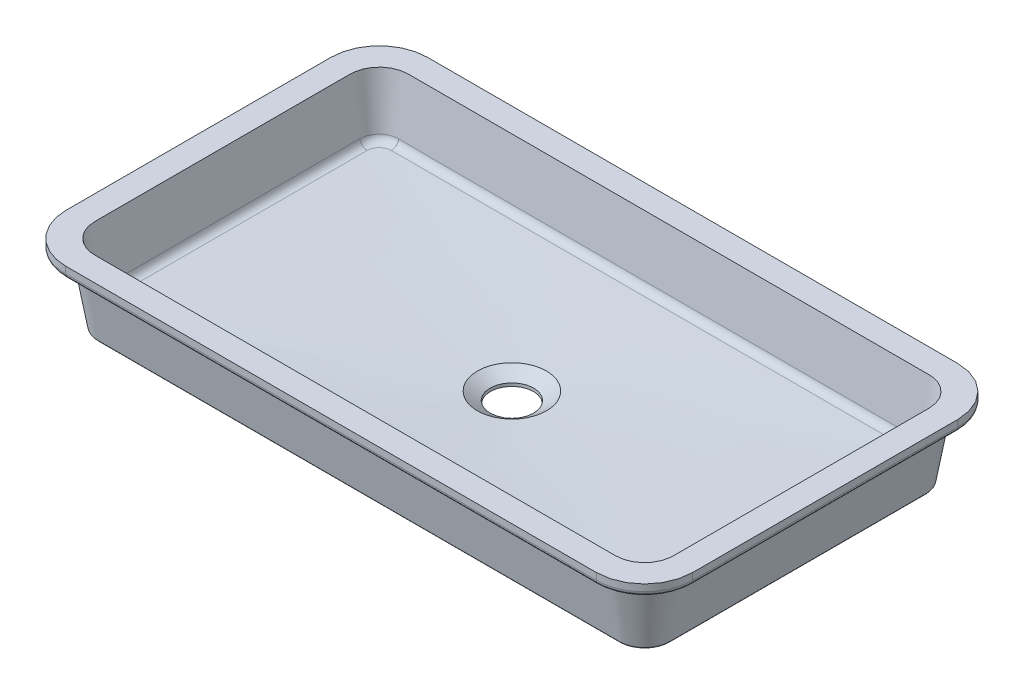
SolidWorks part; units mm, degrees
ref_plane "Front Plane" through (0, 0, 0) normal (0, 0, 1) x (1, 0, 0)
ref_plane "Top Plane" through (0, 0, 0) normal (0, 1, 0) x (1, 0, 0)
ref_plane "Right Plane" through (0, 0, 0) normal (1, 0, 0) x (0, 0, -1)
sketch "Sketch1" plane through (0, 0, 0) normal (0, 1, 0) x (1, 0, 0)
  line L0 (-263.9822, 151.1572) -> (263.7107, 151.1572)
  line L1 (288.7107, 126.1572) -> (288.7107, -126.1572)
  line L2 (263.7107, -151.1572) -> (-263.9822, -151.1572)
  line L3 (-288.9822, -126.1572) -> (-288.9822, 126.1572)
  line L4 (325, 137.5) -> (325, -137.5)
  line L5 (-325, 137.5) -> (-325, -137.5)
  line L6 (275, -187.5) -> (-275, -187.5)
  line L7 (270, 162.5) -> (-270, 162.5)
  line L8 (275, 187.5) -> (-275, 187.5)
  line L9 (300, 132.5) -> (300, -132.5)
  line L10 (270, -162.5) -> (-270, -162.5)
  line L11 (-300, 132.5) -> (-300, -132.5)
  circle A0 centre (0, 0) radius 37.225
  circle A1 centre (0, 0) radius 22.5
  arc A2 (288.7107, 126.1572) -> (263.7107, 151.1572) centre (263.7107, 126.1572) ccw
  arc A3 (263.7107, -151.1572) -> (288.7107, -126.1572) centre (263.7107, -126.1572) ccw
  arc A4 (-288.9822, -126.1572) -> (-263.9822, -151.1572) centre (-263.9822, -126.1572) ccw
  arc A5 (-263.9822, 151.1572) -> (-288.9822, 126.1572) centre (-263.9822, 126.1572) ccw
  arc A6 (275, -187.5) -> (325, -137.5) centre (275, -137.5) ccw
  arc A7 (-275, 187.5) -> (-325, 137.5) centre (-275, 137.5) ccw
  arc A8 (-325, -137.5) -> (-275, -187.5) centre (-275, -137.5) ccw
  arc A9 (270, -162.5) -> (300, -132.5) centre (270, -132.5) ccw
  arc A10 (-300, -132.5) -> (-270, -162.5) centre (-270, -132.5) ccw
  arc A11 (-270, 162.5) -> (-300, 132.5) centre (-270, 132.5) ccw
  arc A12 (325, 137.5) -> (275, 187.5) centre (275, 137.5) ccw
  arc A13 (300, 132.5) -> (270, 162.5) centre (270, 132.5) ccw
  dimension "D1" = 650
  dimension "D2" = 600
  dimension "D3" = 375
  dimension "D4" = 325
sketch "Sketch2" plane through (0, 0, 0) normal (0, 0, 1) x (1, 0, 0)
  line L33 (-300, 0) -> (-289.5688, -60.2292)
  line L34 (-280.9842, -79.9544) -> (-275.3618, -70.683)
  line L35 (-0.1591, 0) -> (0.0462, -79.9544) construction
  line L36 (300, 0) -> (-300, 0)
  line L37 (-300, 0) -> (-325, 0)
  line L38 (-35.725, -68.248) -> (-289.5688, -60.2292)
  line L39 (-310.167, 0) -> (-295.9842, -79.9544)
  line L40 (-280.9842, -79.9544) -> (-295.9842, -79.9544)
  line L41 (-308.0383, -12) -> (-325, -12)
  line L42 (-325, 0) -> (-325, -12)
  line L43 (-35.999, -79.9544) -> (-280.9842, -79.9544)
  line L44 (-35.725, -68.248) -> (35.725, -68.248)
  line L45 (-22.4944, -76.9088) -> (22.4944, -76.9088)
  line L46 (22.4944, -76.9088) -> (22.4305, -79.9544)
  line L47 (35.725, -68.248) -> (22.4944, -76.9088)
  line L48 (-35.725, -68.248) -> (-22.4944, -76.9088)
  line L49 (-22.4944, -76.9088) -> (-22.3027, -79.9544)
  line L50 (-22.4944, -76.9088) -> (22.4944, -76.9088)
  line L51 (-22.3027, -79.9544) -> (22.4305, -79.9544)
  line L52 (-35.999, -79.9544) -> (-22.3027, -79.9544)
  line L53 (300, 0) -> (289.5688, -60.2292)
  line L54 (310.1444, 0) -> (296.112, -79.9544)
  line L55 (35.999, -79.9544) -> (280.9842, -79.9544)
  line L56 (300, 0) -> (325, 0)
  line L57 (308.0383, -12) -> (325, -12)
  line L58 (35.725, -68.248) -> (289.5688, -60.2292)
  line L59 (280.9842, -79.9544) -> (296.112, -79.9544)
  line L60 (325, 0) -> (325, -12)
  line L61 (35.999, -79.9544) -> (22.4305, -79.9544)
  line L62 (-36.0407, -78.243) -> (-35.999, -79.9544)
  line L63 (280.9842, -79.9544) -> (275.3618, -70.683)
  line L64 (36.0407, -78.243) -> (35.999, -79.9544)
  line L65 (36.0407, -78.243) -> (275.3618, -70.683)
  line L66 (-36.0407, -78.243) -> (-275.3618, -70.683)
  arc A2 (-290.2617, -56.2289) -> (-285.4471, -60.3594) centre (-285.3376, -55.3606) ccw
  arc A3 (285.4471, -60.3594) -> (290.2617, -56.2289) centre (285.3376, -55.3606) ccw
sketch "Sketch3" plane through (0, 0, 0) normal (1, 0, 0) x (0, 0, -1)
  line L3 (-36.3948, -78.2243) -> (-138.1814, -71.21)
  line L4 (36.4304, -78.2243) -> (138.1815, -71.2103)
  line L6 (-36.3948, -78.2243) -> (-152.7563, -70.2056) construction
  line L7 (36.4304, -78.2243) -> (152.7565, -70.2056) construction
  line L32 (-162.5, 0) -> (-152.0688, -60.2292)
  line L33 (-172.667, 0) -> (-158.4842, -79.9544)
  line L34 (162.5, 0) -> (-162.5, 0)
  line L35 (-162.5, 0) -> (-187.5, 0)
  line L36 (-170.5383, -12) -> (-187.5, -12)
  line L37 (158.612, -79.9544) -> (-158.4842, -79.9544)
  line L38 (-187.5, 0) -> (-187.5, -12)
  line L39 (162.5, 0) -> (152.0688, -60.2292)
  line L40 (172.6444, 0) -> (158.612, -79.9544)
  line L41 (170.5383, -12) -> (187.5, -12)
  line L42 (187.5, 0) -> (187.5, -12)
  line L43 (162.5, 0) -> (187.5, 0)
  line L44 (-22.3027, -79.9544) -> (22.4305, -79.9544)
  line L45 (143.4842, -79.9544) -> (138.1815, -71.2103)
  line L46 (-143.4842, -79.9544) -> (-138.1814, -71.21)
  line L48 (-35.7073, -68.248) -> (-152.0688, -60.2292)
  line L50 (-35.7073, -68.248) -> (35.7427, -68.248)
  line L51 (-22.4767, -76.9088) -> (22.5122, -76.9088)
  line L52 (22.5122, -76.9088) -> (22.4482, -79.9544)
  line L53 (35.7427, -68.248) -> (22.5122, -76.9088)
  line L54 (-35.7073, -68.248) -> (-22.4767, -76.9088)
  line L55 (-22.4767, -76.9088) -> (-22.2849, -79.9544)
  line L56 (-22.4767, -76.9088) -> (22.5122, -76.9088)
  line L57 (35.7427, -68.248) -> (152.0688, -60.2292)
  line L59 (-36.023, -78.243) -> (-35.9813, -79.9544)
  line L60 (36.0585, -78.243) -> (36.0167, -79.9544)
  dimension "D1" = 10
  dimension "D2" = 10
sketch "Sketch4" plane through (0, 0, 0) normal (0, 1, 0) x (1, 0, 0)
  line L0 (325, 137.5) -> (325, -137.5) construction
  line L1 (275, -187.5) -> (-275, -187.5) construction
  line L2 (-325, 137.5) -> (-325, -137.5) construction
  line L3 (275, 187.5) -> (-275, 187.5) construction
  line L4 (325, 137.5) -> (325, -137.5)
  line L5 (275, -187.5) -> (-275, -187.5)
  line L6 (-325, 137.5) -> (-325, -137.5)
  line L7 (275, 187.5) -> (-275, 187.5)
  arc A0 (325, 137.5) -> (275, 187.5) centre (275, 137.5) ccw construction
  arc A1 (275, -187.5) -> (325, -137.5) centre (275, -137.5) ccw construction
  arc A2 (-325, -137.5) -> (-275, -187.5) centre (-275, -137.5) ccw construction
  arc A3 (-275, 187.5) -> (-325, 137.5) centre (-275, 137.5) ccw construction
  arc A4 (325, 137.5) -> (275, 187.5) centre (275, 137.5) ccw
  arc A5 (275, -187.5) -> (325, -137.5) centre (275, -137.5) ccw
  arc A6 (-325, -137.5) -> (-275, -187.5) centre (-275, -137.5) ccw
  arc A7 (-275, 187.5) -> (-325, 137.5) centre (-275, 137.5) ccw
extrude "Extrude1" add sketch "Sketch4" against normal up to vertex
sketch "Sketch5" plane through (0, 0, 0) normal (0, 1, 0) x (1, 0, 0)
  line L8 (-270, -172.5) -> (270, -172.5)
  line L9 (310, -132.5) -> (310, 132.5)
  line L10 (270, 172.5) -> (-270, 172.5)
  line L11 (-310, 132.5) -> (-310, -132.5)
  line L12 (-270, -172.5) -> (270, -172.5)
  line L13 (310, -132.5) -> (310, 132.5)
  line L14 (270, 172.5) -> (-270, 172.5)
  line L15 (-310, 132.5) -> (-310, -132.5)
  arc A8 (-310, -132.5) -> (-270, -172.5) centre (-270, -132.5) ccw
  arc A9 (270, -172.5) -> (310, -132.5) centre (270, -132.5) ccw
  arc A10 (310, 132.5) -> (270, 172.5) centre (270, 132.5) ccw
  arc A11 (-270, 172.5) -> (-310, 132.5) centre (-270, 132.5) ccw
  arc A12 (-310, -132.5) -> (-270, -172.5) centre (-270, -132.5) ccw
  arc A13 (270, -172.5) -> (310, -132.5) centre (270, -132.5) ccw
  arc A14 (310, 132.5) -> (270, 172.5) centre (270, 132.5) ccw
  arc A15 (-270, 172.5) -> (-310, 132.5) centre (-270, 132.5) ccw
  dimension "D1" = 10
ref_plane "Plane6" through (0, -79.9544, 0) normal (0, 1, 0) x (-1, 0, 0)
sketch "Sketch6" plane through (0, -79.9544, 0) normal (0, 1, 0) x (-1, 0, 0)
  line L3 (-270, 162.5) -> (270, 162.5) construction
  line L5 (-300, -132.5) -> (-300, 132.5) construction
  line L10 (-270, -162.5) -> (270, -162.5) construction
  line L11 (300, -132.5) -> (300, 132.5) construction
  line L18 (-270.0225, -158.612) -> (270.0225, -158.612)
  line L19 (295.9842, -132.6504) -> (295.9842, 132.6504)
  line L20 (270.1504, 158.4842) -> (-270.1504, 158.4842)
  line L21 (-296.112, 132.5225) -> (-296.112, -132.5225)
  arc A12 (-296.112, -132.5225) -> (-270.0225, -158.612) centre (-270.0225, -132.5225) ccw
  arc A13 (270.0225, -158.612) -> (295.9842, -132.6504) centre (270.0225, -132.6504) ccw
  arc A14 (295.9842, 132.6504) -> (270.1504, 158.4842) centre (270.1504, 132.6504) ccw
  arc A15 (-270.1504, 158.4842) -> (-296.112, 132.5225) centre (-270.1504, 132.5225) ccw
  dimension "D1" = 25.9616
loft "Loft1" add profiles "Sketch6", "Sketch5"
sketch "Sketch7" plane through (0, 0, 0) normal (0, 1, 0) x (1, 0, 0)
  line L0 (300, 132.5) -> (300, -132.5) construction
  line L1 (270, -162.5) -> (-270, -162.5) construction
  line L2 (-300, 132.5) -> (-300, -132.5) construction
  line L3 (270, 162.5) -> (-270, 162.5) construction
  line L4 (300, 132.5) -> (300, -132.5)
  line L5 (270, -162.5) -> (-270, -162.5)
  line L6 (-300, 132.5) -> (-300, -132.5)
  line L7 (270, 162.5) -> (-270, 162.5)
  arc A0 (300, 132.5) -> (270, 162.5) centre (270, 132.5) ccw construction
  arc A1 (270, -162.5) -> (300, -132.5) centre (270, -132.5) ccw construction
  arc A2 (-300, -132.5) -> (-270, -162.5) centre (-270, -132.5) ccw construction
  arc A3 (-270, 162.5) -> (-300, 132.5) centre (-270, 132.5) ccw construction
  arc A4 (300, 132.5) -> (270, 162.5) centre (270, 132.5) ccw
  arc A5 (270, -162.5) -> (300, -132.5) centre (270, -132.5) ccw
  arc A6 (-300, -132.5) -> (-270, -162.5) centre (-270, -132.5) ccw
  arc A7 (-270, 162.5) -> (-300, 132.5) centre (-270, 132.5) ccw
ref_plane "Plane7" through (0, -60.2292, 0) normal (0, 1, 0) x (-1, 0, 0)
sketch "Sketch8" plane through (0, -60.2292, 0) normal (0, 1, 0) x (-1, 0, 0)
  line L0 (35.725, 0) -> (289.5688, 0) construction
  line L1 (-35.725, 0) -> (-289.5688, 0) construction
  line L2 (0, -35.7427) -> (0, -152.0688) construction
  line L3 (0, 35.7073) -> (0, 152.0688) construction
  line L12 (-270.5688, 152.0688) -> (270.5688, 152.0688)
  line L13 (289.5688, -133.0688) -> (289.5688, 133.0688)
  line L14 (-289.5688, 133.0688) -> (-289.5688, -133.0688)
  line L15 (-270.5688, -152.0688) -> (270.5688, -152.0688)
  arc A5 (-289.5688, 133.0688) -> (-270.5688, 152.0688) centre (-270.5688, 133.0688) cw
  arc A6 (289.5688, 133.0688) -> (270.5688, 152.0688) centre (270.5688, 133.0688) ccw
  arc A7 (270.5688, -152.0688) -> (289.5688, -133.0688) centre (270.5688, -133.0688) ccw
  arc A8 (-289.5688, -133.0688) -> (-270.5688, -152.0688) centre (-270.5688, -133.0688) ccw
  dimension "D1" = 19
loft "Cut-Loft1" cut profiles "Sketch7", "Sketch8"
sketch "Sketch9" plane through (0, -79.9544, 0) normal (0, 1, 0) x (-1, 0, 0)
  line L6 (22.3027, 0) -> (-22.4305, 0) construction
  line L7 (270.4842, -143.4842) -> (-270.4842, -143.4842)
  line L9 (280.9842, -132.9842) -> (280.9842, 132.9842)
  line L10 (270.4842, 143.4842) -> (-270.4842, 143.4842)
  line L11 (-280.9842, -132.9842) -> (-280.9842, 132.9842)
  arc A1 (-280.9842, 132.9842) -> (-270.4842, 143.4842) centre (-270.4842, 132.9842) cw
  arc A2 (280.9842, 132.9842) -> (270.4842, 143.4842) centre (270.4842, 132.9842) ccw
  arc A3 (270.4842, -143.4842) -> (280.9842, -132.9842) centre (270.4842, -132.9842) ccw
  arc A4 (-280.9842, -132.9842) -> (-270.4842, -143.4842) centre (-270.4842, -132.9842) ccw
  point P7 (-0.0639, 0)
  dimension "D1" = 10.5
extrude "Extrude2" cut sketch "Sketch9" along normal up to vertex draft 30
sketch "Sketch10" plane through (0, -70.683, 0) normal (0, -1, 0) x (1, 0, 0)
  line L4 (270.4842, 138.1313) -> (-270.4842, 138.1313)
  line L5 (-275.6313, 132.9842) -> (-275.6313, -132.9842)
  line L6 (-270.4842, -138.1313) -> (270.4842, -138.1313)
  line L7 (275.6313, -132.9842) -> (275.6313, 132.9842)
  line L8 (270.4842, 138.1313) -> (-270.4842, 138.1313)
  line L9 (-275.6313, 132.9842) -> (-275.6313, -132.9842)
  line L10 (-270.4842, -138.1313) -> (270.4842, -138.1313)
  line L11 (275.6313, -132.9842) -> (275.6313, 132.9842)
  arc A4 (275.6313, 132.9842) -> (270.4842, 138.1313) centre (270.4842, 132.9842) ccw
  arc A5 (-270.4842, 138.1313) -> (-275.6313, 132.9842) centre (-270.4842, 132.9842) ccw
  arc A6 (-275.6313, -132.9842) -> (-270.4842, -138.1313) centre (-270.4842, -132.9842) ccw
  arc A7 (270.4842, -138.1313) -> (275.6313, -132.9842) centre (270.4842, -132.9842) ccw
  arc A8 (275.6313, 132.9842) -> (270.4842, 138.1313) centre (270.4842, 132.9842) ccw
  arc A9 (-270.4842, 138.1313) -> (-275.6313, 132.9842) centre (-270.4842, 132.9842) ccw
  arc A10 (-275.6313, -132.9842) -> (-270.4842, -138.1313) centre (-270.4842, -132.9842) ccw
  arc A11 (270.4842, -138.1313) -> (275.6313, -132.9842) centre (270.4842, -132.9842) ccw
  dimension "D1" = 0
ref_plane "Plane8" through (0, -78.243, 0) normal (0, 1, 0) x (-1, 0, 0)
sketch "Sketch12" plane through (0, -78.243, 0) normal (0, 1, 0) x (-1, 0, 0)
  circle A0 centre (0, 0) radius 36.0407
loft "Loft2" add profiles "Sketch10", "Sketch12"
sketch "Sketch13" plane through (0, 0, 0) normal (0, 0, 1) x (1, 0, 0)
  line L0 (-22.3027, -79.9544) -> (22.4305, -79.9544) construction
  line L1 (-36.0407, -78.243) -> (-35.999, -79.9544) construction
  line L2 (-35.999, -79.9544) -> (0, -79.9544)
  line L3 (-36.1498, -73.7699) -> (-35.999, -79.9544)
  line L5 (-36.1498, -73.7699) -> (0, -73.7699)
  line L6 (0, -73.7699) -> (0, -79.9544)
  line L7 (0, -79.9544) -> (0, 0) construction
revolve "Revolve1" add sketch "Sketch13" angle 360 about L7
sketch "Sketch14" plane through (0, -60.2292, 0) normal (0, 1, 0) x (1, 0, 0)
  line L4 (270.5688, 152.0688) -> (-270.5688, 152.0688)
  line L5 (-289.5688, 133.0688) -> (-289.5688, -133.0688)
  line L6 (-270.5688, -152.0688) -> (270.5688, -152.0688)
  line L7 (289.5688, -133.0688) -> (289.5688, 133.0688)
  line L8 (270.5688, 152.0688) -> (-270.5688, 152.0688)
  line L9 (-289.5688, 133.0688) -> (-289.5688, -133.0688)
  line L10 (-270.5688, -152.0688) -> (270.5688, -152.0688)
  line L11 (289.5688, -133.0688) -> (289.5688, 133.0688)
  arc A4 (289.5688, 133.0688) -> (270.5688, 152.0688) centre (270.5688, 133.0688) ccw
  arc A5 (-270.5688, 152.0688) -> (-289.5688, 133.0688) centre (-270.5688, 133.0688) ccw
  arc A6 (-289.5688, -133.0688) -> (-270.5688, -152.0688) centre (-270.5688, -133.0688) ccw
  arc A7 (270.5688, -152.0688) -> (289.5688, -133.0688) centre (270.5688, -133.0688) ccw
  arc A8 (289.5688, 133.0688) -> (270.5688, 152.0688) centre (270.5688, 133.0688) ccw
  arc A9 (-270.5688, 152.0688) -> (-289.5688, 133.0688) centre (-270.5688, 133.0688) ccw
  arc A10 (-289.5688, -133.0688) -> (-270.5688, -152.0688) centre (-270.5688, -133.0688) ccw
  arc A11 (270.5688, -152.0688) -> (289.5688, -133.0688) centre (270.5688, -133.0688) ccw
  dimension "D1" = 0
ref_plane "Plane9" through (0, -68.248, 0) normal (0, 1, 0) x (-1, 0, 0)
sketch "Sketch15" plane through (0, -68.248, 0) normal (0, 1, 0) x (-1, 0, 0)
  line L0 (35.725, 0) -> (-35.725, 0) construction
  circle A0 centre (0, 0) radius 35.725
loft "Cut-Loft2" cut profiles "Sketch14", "Sketch15"
sketch "Sketch16" plane through (0, 0, 0) normal (0, 0, 1) x (1, 0, 0)
  line L1 (-22.4944, -76.9088) -> (-22.3027, -79.9544) construction
  line L2 (-35.725, -68.248) -> (-22.4944, -76.9088) construction
  line L3 (-40.6688, -65.0117) -> (0.0514, -65.0117)
  line L4 (-22.4944, -76.9088) -> (-22.1757, -81.9701)
  line L5 (-40.6688, -65.0117) -> (-22.4944, -76.9088)
  line L7 (-22.1757, -81.9701) -> (0.0514, -81.9701)
  line L9 (0.0514, -65.0117) -> (0.0514, -81.9701)
  line L11 (0.0514, -81.9701) -> (0.0514, -53.1556) construction
revolve "Cut-Revolve2" cut sketch "Sketch16" angle 360 about L11
fillet "Fillet1" radius 8 8 edges
fillet "Fillet2" radius 2 1 edges
fillet "Fillet3" radius 5 8 edges at (-273.7095, -70.683, -136.9955) (0, -70.683, -138.1313) (274.4955, -70.683, -136.2095) (275.6313, -70.683, 0) (273.7095, -70.683, 136.9955) (0, -70.683, 138.1313) (-274.4955, -70.683, 136.2095) (-275.6313, -70.683, 0)
fillet "Fillet4" radius 1.5 16 edges at (277.9088, -79.9544, 140.4088) (280.9842, -79.9544, 0) (277.9088, -79.9544, -140.4088) (0, -79.9544, -143.4842) (-277.9088, -79.9544, -140.4088) (-280.9842, -79.9544, 0) (-277.9088, -79.9544, 140.4088) (0, -79.9544, 143.4842)
fillet "Fillet5" radius 1.5 1 edges at (0, -79.9544, -35.999)
fillet "Fillet6" radius 5 8 edges at (-310.3553, -12, 172.8553) (-325, -12, 0) (-310.3553, -12, -172.8553) (0, -12, -187.5) (310.3553, -12, -172.8553) (325, -12, 0) (310.3553, -12, 172.8553) (0, -12, 187.5)
